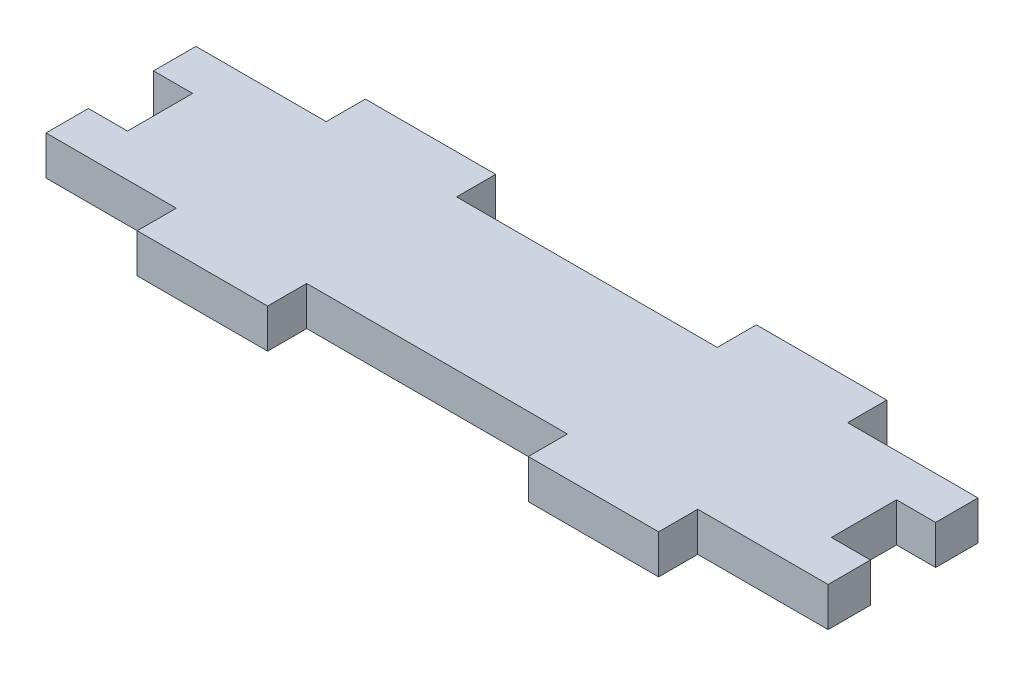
SolidWorks part; units mm, degrees
ref_plane "Alzado" through (0, 0, 0) normal (0, 0, 1) x (1, 0, 0)
ref_plane "Planta" through (0, 0, 0) normal (0, 1, 0) x (1, 0, 0)
ref_plane "Vista lateral" through (0, 0, 0) normal (1, 0, 0) x (0, 0, -1)
sketch "Croquis1" plane through (0, 0, 0) normal (0, 1, 0) x (1, 0, 0)
  line L0 (0, 11) -> (0, -6.5) construction
  line L1 (-30, -6.5) -> (30, -6.5)
  line L2 (-30, -6.5) -> (-30, 11)
  line L3 (-30, 11) -> (30, 11)
  line L4 (30, -6.5) -> (30, 11)
  line L5 (-30, 2.25) -> (30, 2.25) construction
extrude "Saliente-Extruir1" add sketch "Croquis1" along normal blind 3
sketch "Croquis3" plane through (0, 3, 0) normal (0, 1, 0) x (1, 0, 0)
  line L0 (-30, 4.75) -> (-30, -0.25)
  line L1 (-30, 4.75) -> (-27, 4.75)
  line L2 (-30, -0.25) -> (-27, -0.25)
  line L3 (-27, 4.75) -> (-27, -0.25)
  line L4 (-30, 11) -> (-30, -6.5) construction
  line L5 (30, -6.5) -> (30, 11) construction
  point P8 (30, 2.25)
  point P9 (-27, 2.25)
extrude "Cortar-Extruir3" cut sketch "Croquis3" against normal up to surface (3 mm away)
mirror "Simetría1" about plane through (0, 0, 0) normal (1, 0, 0) of "Cortar-Extruir3"
extrude "Cortar-Extruir4" cut sketch "Croquis4" against normal through all both and the other way through all
sketch "Croquis4" plane through (76.0453, 0, -111) normal (0, -1, 0) x (1, 0, 0)
  line L24 (-96.0453, 100) -> (-96.0453, 103)
  line L25 (-96.0453, 103) -> (-106.0453, 103)
  line L26 (-106.0453, 103) -> (-106.0453, 100)
  line L27 (-106.0453, 100) -> (-96.0453, 100)
  line L28 (-86.0453, 103) -> (-86.0453, 100)
  line L29 (-86.0453, 100) -> (-66.0453, 100)
  line L30 (-66.0453, 100) -> (-66.0453, 103)
  line L31 (-66.0453, 103) -> (-86.0453, 103)
  line L32 (-46.0453, 103) -> (-56.0453, 103)
  line L33 (-56.0453, 103) -> (-56.0453, 100)
  line L34 (-56.0453, 100) -> (-46.0453, 100)
  line L35 (-46.0453, 100) -> (-46.0453, 103)
  line L36 (-46.0453, 117.5) -> (-56.0453, 117.5)
  line L37 (-56.0453, 117.5) -> (-56.0453, 114.5)
  line L38 (-56.0453, 114.5) -> (-46.0453, 114.5)
  line L39 (-46.0453, 114.5) -> (-46.0453, 117.5)
  line L40 (-86.0453, 117.5) -> (-86.0453, 114.5)
  line L41 (-86.0453, 114.5) -> (-66.0453, 114.5)
  line L42 (-66.0453, 114.5) -> (-66.0453, 117.5)
  line L43 (-66.0453, 117.5) -> (-86.0453, 117.5)
  line L44 (-96.0453, 114.5) -> (-96.0453, 117.5)
  line L45 (-96.0453, 117.5) -> (-106.0453, 117.5)
  line L46 (-106.0453, 117.5) -> (-106.0453, 114.5)
  line L47 (-106.0453, 114.5) -> (-96.0453, 114.5)
equation "\"ancho\"= 17.5"
equation "\"grosor\"= 3"
equation "\"D2@Croquis1\"=\"ancho\""
equation "\"D1@Saliente-Extruir1\"=\"grosor\""
equation "\"D1@Croquis3\"=\"grosor\""
equation "\"D2@Croquis3\"=\"ancho\"/3.5"
